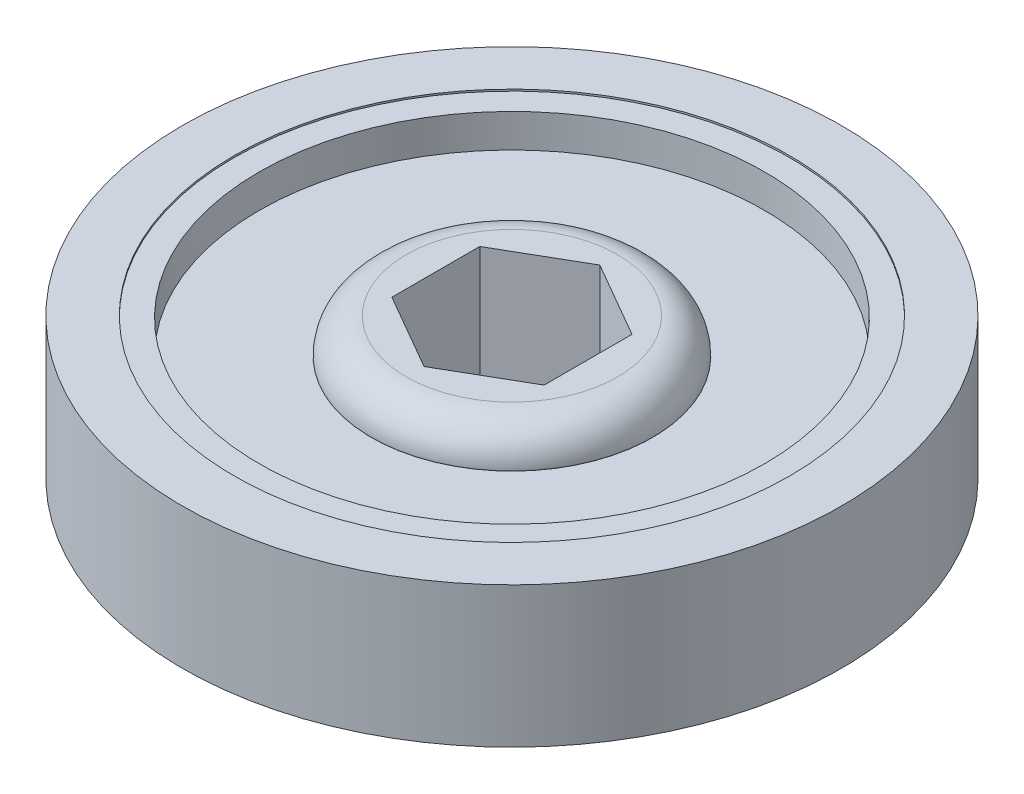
SolidWorks part; units mm, degrees
ref_plane "Front Plane" through (0, 0, 0) normal (0, 0, 1) x (1, 0, 0)
ref_plane "Top Plane" through (0, 0, 0) normal (0, 1, 0) x (1, 0, 0)
ref_plane "Right Plane" through (0, 0, 0) normal (1, 0, 0) x (0, 0, -1)
sketch "Sketch2" plane through (0, 0, 0) normal (0, 0, 1) x (1, 0, 0)
  line L0 (0, 0) -> (23.8125, 0) construction
  line L1 (0, 0) -> (7.6454, 0)
  line L2 (10.16, -2.5146) -> (10.16, -2.54)
  line L3 (10.16, -2.54) -> (18.2628, -2.54)
  line L4 (18.2628, -2.54) -> (18.2628, -0.127)
  line L5 (18.2628, -0.127) -> (20.0609, -0.127)
  line L6 (20.0609, -0.127) -> (20.0609, 0)
  line L7 (20.0609, 0) -> (23.8125, 0)
  line L8 (0, 0) -> (0, -10.16) construction
  line L9 (0, -5.08) -> (23.8125, -5.08) construction
  line L10 (0, -10.16) -> (23.8125, -10.16) construction
  line L11 (20.0609, -10.16) -> (23.8125, -10.16)
  line L12 (20.0609, -10.033) -> (20.0609, -10.16)
  line L13 (18.2628, -10.033) -> (20.0609, -10.033)
  line L14 (18.2628, -7.62) -> (18.2628, -10.033)
  line L15 (10.16, -7.62) -> (18.2628, -7.62)
  line L16 (10.16, -7.6454) -> (10.16, -7.62)
  line L17 (0, -10.16) -> (7.6454, -10.16)
  line L18 (23.8125, 0) -> (23.8125, -10.16)
  line L19 (0, 0) -> (0, -10.16)
  arc A0 (7.6454, 0) -> (10.16, -2.5146) centre (7.6454, -2.5146) cw
  arc A1 (7.6454, -10.16) -> (10.16, -7.6454) centre (7.6454, -7.6454) ccw
  point P14 (10.16, 0)
  point P24 (10.16, -10.16)
  dimension "D6" = 2.5146
  dimension "D1" = 23.8125
  dimension "D2" = 10.16
  dimension "D3" = 2.54
  dimension "D4" = 10.16
  dimension "D5" = 0.127
revolve "Revolve1" add sketch "Sketch2" angle 360 about L19
sketch "Sketch3" plane through (0, 0, 0) normal (0, 1, 0) x (1, 0, 0)
  line L1 (0, 6.35) -> (-5.4993, 3.175)
  line L2 (-5.4993, 3.175) -> (-5.4993, -3.175)
  line L3 (-5.4993, -3.175) -> (0, -6.35)
  line L4 (0, -6.35) -> (5.4993, -3.175)
  line L5 (5.4993, -3.175) -> (5.4993, 3.175)
  line L6 (5.4993, 3.175) -> (0, 6.35)
  circle A0 centre (0, 0) radius 6.35 construction
extrude "Cut-Extrude1" cut sketch "Sketch3" against normal through all
